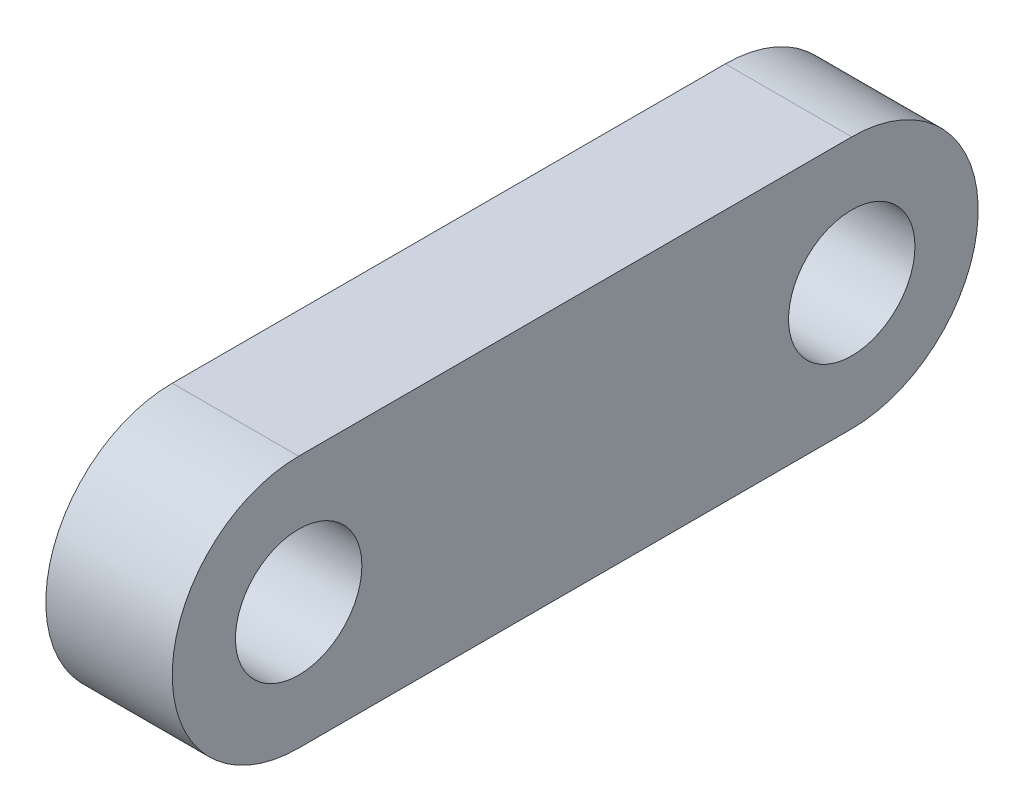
SolidWorks part; units mm, degrees
ref_plane "Front Plane" through (0, 0, 0) normal (0, 0, 1) x (1, 0, 0)
ref_plane "Top Plane" through (0, 0, 0) normal (0, 1, 0) x (1, 0, 0)
ref_plane "Right Plane" through (0, 0, 0) normal (1, 0, 0) x (0, 0, -1)
sketch "Sketch1" plane through (0, 0, 0) normal (1, 0, 0) x (0, 0, -1)
  line L0 (-87.5, 0) -> (87.5, 0) construction
  line L1 (-87.5, 40) -> (87.5, 40)
  line L2 (-87.5, -40) -> (87.5, -40)
  arc A0 (-87.5, 40) -> (-87.5, -40) centre (-87.5, 0) ccw
  arc A1 (87.5, -40) -> (87.5, 40) centre (87.5, 0) ccw
  circle A2 centre (-87.5, 0) radius 20
  circle A3 centre (87.5, 0) radius 20
  point P2 (0, 0)
  dimension "D2" = 40
  dimension "D3" = 40
  dimension "D4" = 40
  dimension "D1" = 175
extrude "Boss-Extrude1" add sketch "Sketch1" along normal mid plane 40
